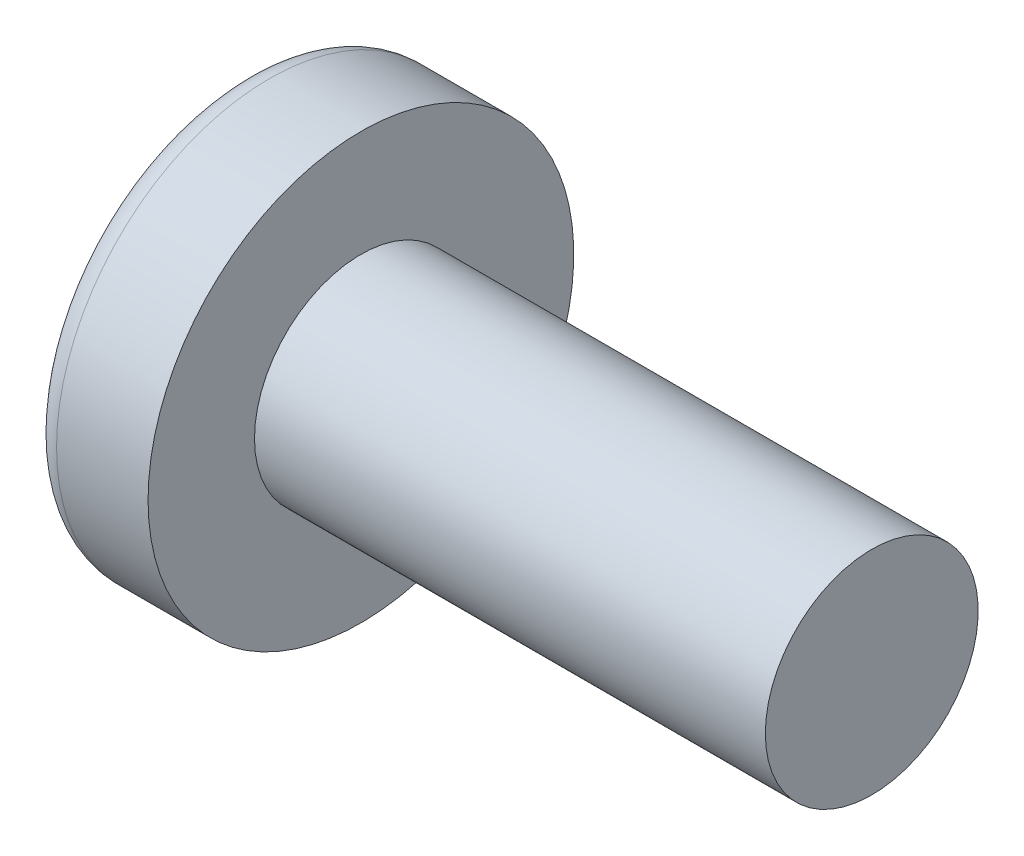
SolidWorks part; units mm, degrees
ref_plane "Plane1" through (0, 0, 0) normal (0, 0, 1) x (1, 0, 0)
ref_plane "Plane2" through (0, 0, 0) normal (0, 1, 0) x (1, 0, 0)
ref_plane "Plane3" through (0, 0, 0) normal (1, 0, 0) x (0, 0, -1)
sketch "BodySke" plane through (0, 0, 0) normal (0, 0, 1) x (1, 0, 0)
  line L0 (2.1, 1.25) -> (2.1, 2.5)
  line L1 (2.55, 6.35) -> (2.55, -3.175) construction
  line L2 (-25.4, 0) -> (127, 0) construction
  line L3 (8.1, 0) -> (0, 0)
  line L4 (2.1, 1.25) -> (8.1, 1.25)
  line L5 (8.1, 1.25) -> (8.1, 0)
  line L6 (1.0251, 2.5) -> (2.1, 2.5)
  line L7 (2.1, -1.25) -> (8.1, -1.25) construction
  line L8 (2.1, 6.35) -> (2.1, -3.175) construction
  arc A0 (0.7839, 2.3784) -> (0, 0) centre (4, 0) ccw
  arc A2 (0.7839, 2.3784) -> (1.0251, 2.5) centre (1.0251, 2.2) cw
revolve "Base-Revolve" add sketch "BodySke" angle 360 about L2
sketch "Sketch3" plane through (0, 0, 0) normal (1, 0, 0) x (0, 0, -1)
  line L0 (0.35, -1.34) -> (-0.35, -1.34)
  line L1 (0.35, -1.34) -> (0.35, 1.34)
  line L2 (-0.35, 1.34) -> (0.35, 1.34)
  line L3 (-0.35, 1.34) -> (-0.35, -1.34)
ref_plane "Plane4" through (1.53, 0, 0) normal (1, 0, 0) x (0, 0, -1)
sketch "Sketch4" plane through (1.53, 0, 0) normal (1, 0, 0) x (0, 0, -1)
  line L0 (0.175, -0.175) -> (-0.175, -0.175)
  line L1 (0.175, -0.175) -> (0.175, 0.175)
  line L2 (-0.175, 0.175) -> (0.175, 0.175)
  line L3 (-0.175, 0.175) -> (-0.175, -0.175)
loft "Cut-Loft1" cut profiles "Sketch3", "Sketch4"
pattern_circular "CirPattern1" count 2 every 90 about axis through (0, 0, 0) along (1, 0, 0) of "Cut-Loft1"
sketch "ThdSchSke" plane through (0, 0, 0) normal (0, 0, 1) x (1, 0, 0)
  line L0 (2.55, -0.9965) -> (2.3725, -1.25)
  line L1 (2.55, -0.9965) -> (2.7275, -1.25)
  line L2 (2.7275, -1.25) -> (2.7275, -1.5625)
  line L3 (-3.175, 0) -> (5.1513, 0) construction
  line L5 (2.7275, -1.5625) -> (2.3725, -1.5625)
  line L6 (2.3725, -1.5625) -> (2.3725, -1.25)
revolve "ThreadSchematic" [suppressed] cut sketch "ThdSchSke" angle 360 about L3
pattern_linear "ThdSchPat" [suppressed]
equation "\"D1@Sketch3\" = \"Cross_dia@Sketch3\" / 2"
equation "\"D2@Sketch3\" = \"Cross_width@Sketch3\" / 2"
equation "\"D1@Sketch4\" = \"Cross_width@Sketch3\" *.5"
equation "\"D2@Sketch4\" = \"D1@Sketch4\""
equation "\"D3@Sketch4\" = \"D1@Sketch4\" / 2"
equation "\"D4@Sketch4\" = \"D2@Sketch4\" / 2"
equation "\"Thread_length@ThreadCosmetic\" = ((sgn( (\"Length@BodySke\" - \"Advance@BodySke\" ) - \"Thread_nom@BodySke\" )-1)*( (\"Length@BodySke\" - \"Advance@BodySke\" ) - \"Thread_nom@BodySke\" ))/-2+ \"Thread_nom@BodySke\""
equation "\"Thread_minor@ThdSchSke\" = \"Thread_minor@ThreadCosmetic\""
equation "\"Diameter@ThdSchSke\" = \"Diameter@BodySke\""
equation "\"Overcut@ThdSchSke\" = \"Diameter@BodySke\" * 1.25"
equation "\"Start@ThdSchSke\" = \"Head_ht@BodySke\" + \"Length@BodySke\" - \"Thread_length@ThreadCosmetic\"  '---Non-countersunk---"
equation "\"Num_threads@ThdSchPat\" = int( \"Thread_length@ThreadCosmetic\" / \"Advance@BodySke\" + 0.999 )  + 1"
equation "\"Advance@ThdSchPat\" = \"Thread_length@ThreadCosmetic\" /  (\"Num_threads@ThdSchPat\" - 1) 'relax it"
